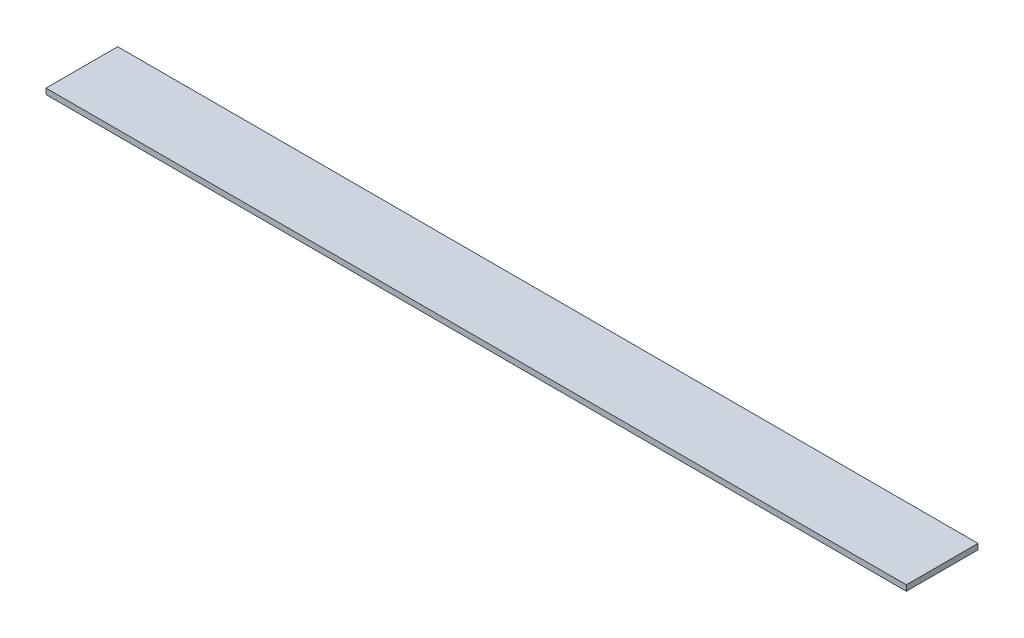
SolidWorks part; units mm, degrees
ref_plane "Front Plane" through (0, 0, 0) normal (0, 0, 1) x (1, 0, 0)
ref_plane "Top Plane" through (0, 0, 0) normal (0, 1, 0) x (1, 0, 0)
ref_plane "Right Plane" through (0, 0, 0) normal (1, 0, 0) x (0, 0, -1)
sketch "Sketch1" plane through (0, 0, 0) normal (0, 1, 0) x (1, 0, 0)
  line L1 (-304.8, -25.4) -> (304.8, -25.4)
  line L2 (-304.8, -25.4) -> (-304.8, 25.4)
  line L3 (-304.8, 25.4) -> (304.8, 25.4)
  line L4 (304.8, -25.4) -> (304.8, 25.4)
  line L5 (-304.8, -25.4) -> (304.8, 25.4) construction
  line L6 (-304.8, 25.4) -> (304.8, -25.4) construction
  point P1 (0, 0)
  dimension "D1" = 609.6
  dimension "D2" = 50.8
extrude "Boss-Extrude1" add sketch "Sketch1" along normal blind 4
